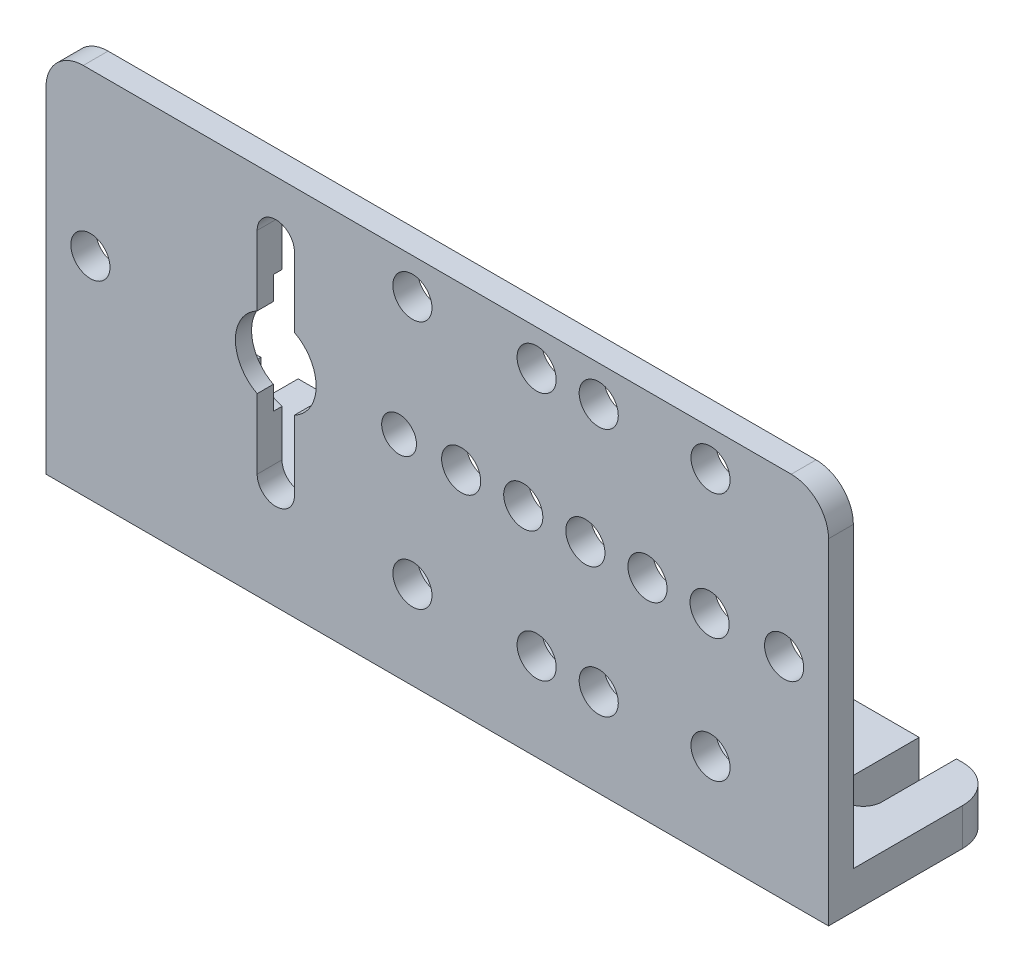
SolidWorks part; units mm, degrees
ref_plane "Plan de face" through (0, 0, 0) normal (0, 0, 1) x (1, 0, 0)
ref_plane "Plan de dessus" through (0, 0, 0) normal (0, 1, 0) x (1, 0, 0)
ref_plane "Plan de droite" through (0, 0, 0) normal (1, 0, 0) x (0, 0, -1)
mirrored part "Equerre support_Rendre symétrique"
other "<Equerre support>-<Enlèv. mat.-Extru.5>"
